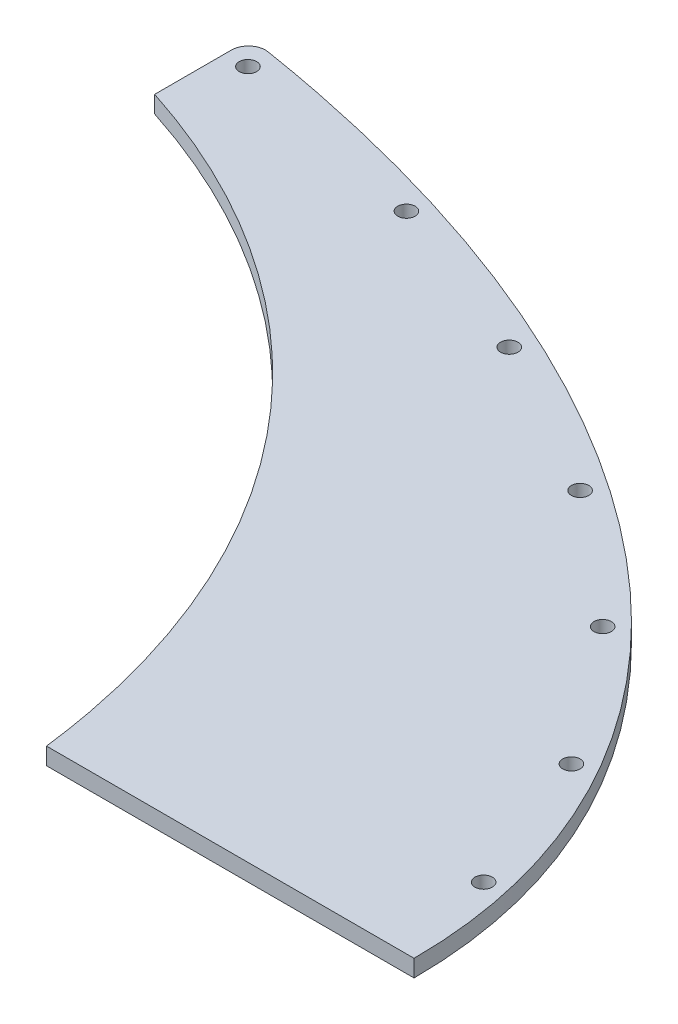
SolidWorks part; units mm, degrees
ref_plane "Front Plane" through (0, 0, 0) normal (0, 0, 1) x (1, 0, 0)
ref_plane "Top Plane" through (0, 0, 0) normal (0, 1, 0) x (1, 0, 0)
ref_plane "Right Plane" through (0, 0, 0) normal (1, 0, 0) x (0, 0, -1)
sketch "Sketch1" plane through (0, 0, 0) normal (0, 1, 0) x (1, 0, 0)
  line L0 (0, 0) -> (-136.6563, 0)
  line L1 (-326.39, 229.9599) -> (-326.39, 258.4495)
  circle A0 centre (-317.9773, 256.2194) radius 3.2385
  arc A2 (-319.0363, 264.7196) -> (-326.39, 258.4495) centre (-320.04, 258.4495) ccw
  circle A3 centre (-241.9611, 239.1265) radius 3.2385
  circle A5 centre (-179.0607, 214.4563) radius 3.2385
  circle A7 centre (-119.7575, 181.4975) radius 3.2385
  circle A9 centre (-71.7422, 141.8599) radius 3.2385
  circle A11 centre (-33.3182, 91.8261) radius 3.2385
  circle A13 centre (-11.5781, 37.4402) radius 3.2385
  ellipse E0 centre (-419.2496, 0) end of major axis (0, 0) minor radius 272.6224 (-319.0363, 264.7196) -> (0, 0) cw
  ellipse E1 centre (-458.3504, -71.712) end of major axis (-196.3828, 141.8599) minor radius 301.4438 (-326.39, 229.9599) -> (-136.6563, 0) cw
  dimension "D3" = 264.7196
  dimension "D2" = 6.35
  dimension "D1" = 326.39
extrude "Extrude1" add sketch "Sketch1" along normal blind 6.35
